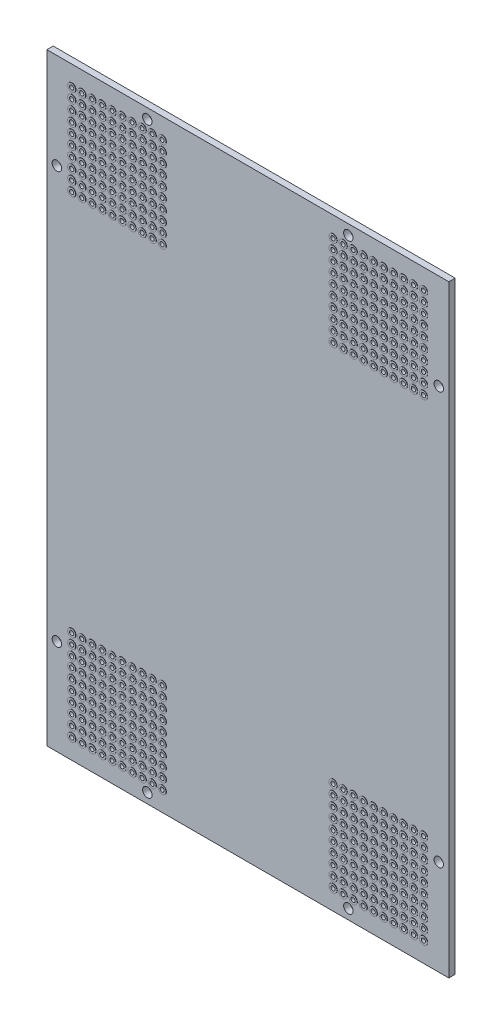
SolidWorks part; units mm, degrees
ref_plane "Front Plane" through (0, 0, 0) normal (0, 0, 1) x (1, 0, 0)
ref_plane "Top Plane" through (0, 0, 0) normal (0, 1, 0) x (1, 0, 0)
ref_plane "Right Plane" through (0, 0, 0) normal (1, 0, 0) x (0, 0, -1)
sketch "Sketch1" plane through (0, 0, 0) normal (0, 0, 1) x (1, 0, 0)
  line L1 (-50.8, -76.2) -> (50.8, -76.2)
  line L2 (-50.8, -76.2) -> (-50.8, 76.2)
  line L3 (-50.8, 76.2) -> (50.8, 76.2)
  line L4 (50.8, -76.2) -> (50.8, 76.2)
  line L5 (-50.8, -76.2) -> (50.8, 76.2) construction
  line L6 (-50.8, 76.2) -> (50.8, -76.2) construction
  point P0 (0, 0)
  dimension "D1" = 101.6
  dimension "D2" = 152.4
extrude "Boss-Extrude1" add sketch "Sketch1" along normal blind 1.6002
ref_plane "Plane1" through (0, 0, 1.6764) normal (0, 0, 1) x (1, 0, 0)
sketch "Sketch7" plane through (0, 0, 1.6764) normal (0, 0, 1) x (1, 0, 0)
  line L0 (-50.8, 76.2) -> (-50.8, -76.2) construction
  line L1 (50.8, 76.2) -> (-50.8, 76.2) construction
  circle A0 centre (-44.45, 71.12) radius 1.016
  dimension "D1" = 2.032
  dimension "D2" = 6.35
  dimension "D3" = 5.08
extrude "Boss-Extrude2" add sketch "Sketch7" against normal offset from surface (1.7526 mm away) 0.0762
hole_wizard "#58 (0.042) Diameter Hole1" positions "Sketch4" profile "Sketch5" hole size "#58" standard "ANSI Inch"
sketch "Sketch4" plane through (0, 0, 1.6764) normal (0, 0, 1) x (1, 0, 0)
  circle A0 centre (-44.45, 71.12) radius 1.016 construction
  point P0 (-44.45, 71.12)
  point P7 (0, 0)
sketch "Sketch5" plane through (-44.45, 71.12, 1.6764) normal (1, 0, 0) x (0, -1, 0)
  line L0 (0, 0) -> (0, 1.7526)
  line L1 (0, 1.7526) -> (0.5334, 1.7526)
  line L2 (0.5334, 1.7526) -> (0.5334, 0)
  line L5 (0.5334, 0) -> (0, 0)
  line L11 (0, -6.35) -> (0, 107.95) construction
  dimension "Thru Hole Dia." = 1.0668
  dimension "Thru Hole Depth" = 1.7526
pattern_linear "LPattern1" count 10 spacing 2.54 along (0, -1, 0) count 10 spacing 2.54 along (1, 0, 0) of "Boss-Extrude2", "#58 (0.042) Diameter Hole1"
hole_wizard "3/32 (0.09375) Diameter Hole1" positions "Sketch8" profile "Sketch9" hole size "3/32" standard "ANSI Inch"
sketch "Sketch8" plane through (0, 0, 1.6002) normal (0, 0, 1) x (1, 0, 0)
  line L0 (-50.8, 76.2) -> (-50.8, -76.2) construction
  line L1 (-50.8, -76.2) -> (50.8, -76.2) construction
  point P0 (-25.4, -73.66)
  point P2 (-48.26, -52.07)
  point P12 (0, 0)
  dimension "D1" = 2.54
  dimension "D2" = 24.13
  dimension "D3" = 2.54
  dimension "D4" = 25.4
sketch "Sketch9" plane through (-25.4, -73.66, 1.6002) normal (1, 0, 0) x (0, -1, 0)
  line L0 (0, 0) -> (0, 1.6764)
  line L1 (0, 1.6764) -> (1.1906, 1.6764)
  line L2 (1.1906, 1.6764) -> (1.1906, 0)
  line L5 (1.1906, 0) -> (0, 0)
  line L11 (0, -6.35) -> (0, 107.95) construction
  dimension "Thru Hole Dia." = 2.3812
  dimension "Thru Hole Depth" = 1.6764
mirror "Mirror1" about plane through (0, 0, 0) normal (1, 0, 0) of "3/32 (0.09375) Diameter Hole1", "LPattern1", "Boss-Extrude2", "#58 (0.042) Diameter Hole1"
mirror "Mirror2" about plane through (0, 0, 0) normal (0, 1, 0) of "Mirror1", "Boss-Extrude2", "#58 (0.042) Diameter Hole1", "LPattern1", "3/32 (0.09375) Diameter Hole1"
